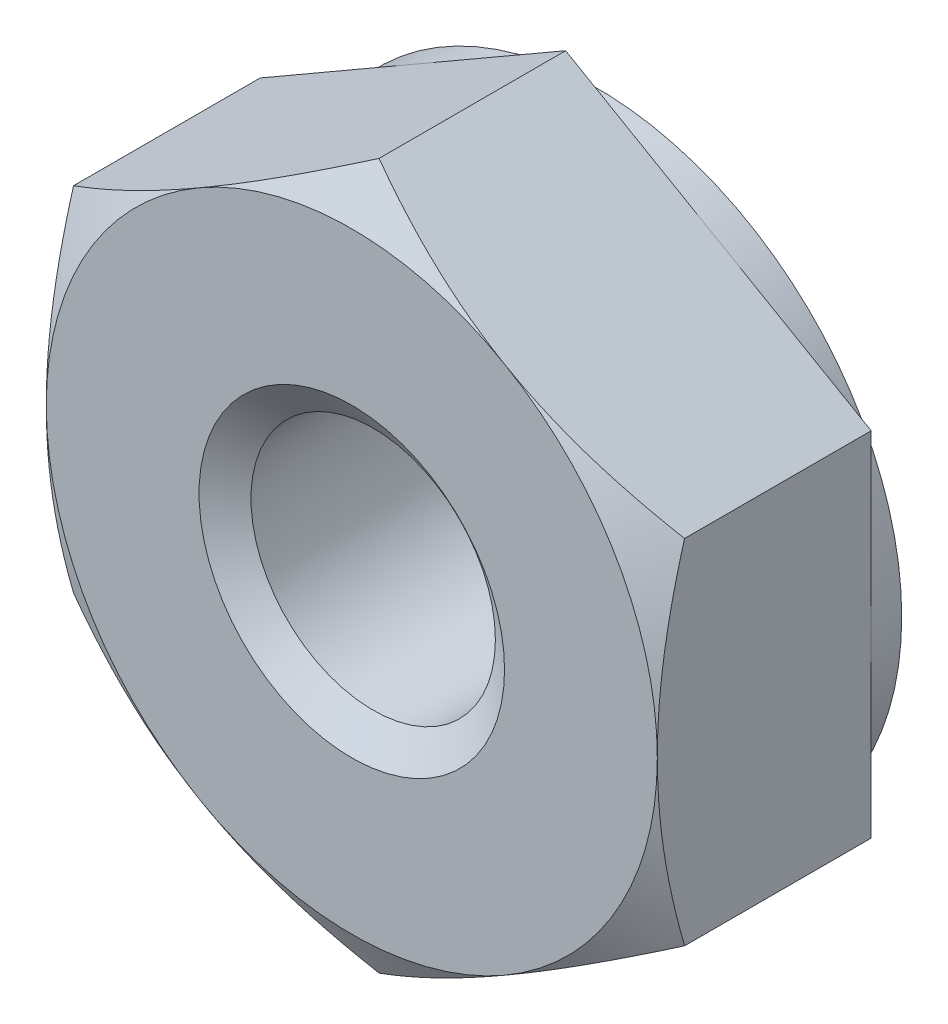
SolidWorks part; units mm, degrees
ref_plane "Plane1" through (0, 0, 0) normal (0, 0, 1) x (1, 0, 0)
ref_plane "Plane2" through (0, 0, 0) normal (0, 1, 0) x (1, 0, 0)
ref_plane "Plane3" through (0, 0, 0) normal (1, 0, 0) x (0, 0, -1)
revolve "EndChamfer" cut sketch "Sketch5"
sketch "Sketch5"
  line L0 (1.5746, 1) -> (1.4206, 0.78)
  line L1 (1.6254, 1) -> (1.5746, 1)
  line L2 (1.6254, 1) -> (1.6254, 0.78)
  line L3 (1.6254, 0.78) -> (1.4206, 0.78)
  line L6 (-0.0508, 1) -> (0, 1)
  line L7 (0, 1) -> (0.154, 0.78)
  line L9 (0.154, 0.78) -> (-0.0508, 0.78)
  line L10 (-0.0508, 0.78) -> (-0.0508, 1)
  line L11 (25.0375, 0) -> (38.388, 0) construction
  line L12 (1.6, 0) -> (0, 0) construction
extrude "BaseNut" add sketch "BaseNutSke" against normal blind 1.6
sketch "BaseNutSke" plane through (0, 0, 0) normal (0, 0, 1) x (1, 0, 0)
  line L6 (2, 1.1547) -> (2, -1.1547)
  line L7 (-2, 1.1547) -> (-2, -1.1547)
  line L8 (2, 1.1547) -> (0, 2.3094)
  line L9 (0, 2.3094) -> (-2, 1.1547)
  line L10 (-2, -1.1547) -> (0, -2.3094)
  line L11 (0, -2.3094) -> (2, -1.1547)
  circle A0 centre (0, 0) radius 0.8
  dimension "D4" = 2
  dimension "Tap_drill" = 1.6
  dimension "D1" = 120
  dimension "D2" = 2
  dimension "D3" = 2
  dimension "Width_flats" = 4
pattern_linear "ThdSchPat" [suppressed]
revolve "ThreadSchematic" cut sketch "ThdSchSke" angle 360 about L11
sketch "ThdSchSke" plane through (0, 0, 0) normal (0, 1, 0) x (1, 0, 0)
  line L0 (-1, 0.0254) -> (-0.8, 0.1654)
  line L1 (-0.8, 0.1654) -> (-0.4, 0.1654)
  line L2 (-0.4, 0.1654) -> (-0.4, -0.1146)
  line L3 (-0.4, -0.1146) -> (-0.8, -0.1146)
  line L4 (-0.8, -0.1146) -> (-1, 0.0254)
  line L5 (-3.175, 0.4) -> (3.175, 0.4) construction
  line L6 (0, 0.4) -> (0, -2.9874) construction
  line L7 (0, 1.4346) -> (0, 0.14) construction
  dimension "D1" = 35
  dimension "VeeAngle" = 70
  dimension "SideAngle" = 55
  dimension "D2" = 0.0508
  dimension "OverCut" = 0.8
  dimension "Tap_Drill" = 1.6
  dimension "Advance" = 0.3873
  dimension "Thread_major" = 2
  dimension "Num_threads" = 5
  dimension "D4" = 50
  dimension "Offset1" = 1.6254
  dimension "ThreadMajor" = 1
  dimension "ChamferDepth" = 0.22
  dimension "Offset2" = 1.6762
sketch "Sketch4" plane through (0, 0, 0) normal (1, 0, 0) x (0, 0, -1)
  line L0 (1.6, 2) -> (1.4, 2)
  line L1 (1.6, 2) -> (1.6, 12.3094)
  line L2 (1.4, 12.3094) -> (1.6, 12.3094)
  line L3 (1.4, 12.3094) -> (1.4, 2)
  line L4 (0, 0) -> (34.925, 0) construction
  line L6 (1.6, 1.1547) -> (1.6, 2.3094) construction
  line L7 (0, 2) -> (-10, 2)
  line L8 (0, 1.1547) -> (0, 2.3094) construction
  line L9 (0.1786, 2.3094) -> (0.1786, 12.3094)
  line L10 (0.1786, 12.3094) -> (-10, 12.3094)
  line L11 (-10, 12.3094) -> (-10, 2)
  line L12 (0, 2) -> (0.1786, 2.3094)
  line L14 (0, 1.1547) -> (0, -1.1547) construction
  line L15 (1.6, 2.3094) -> (0, 2.3094) construction
  dimension "D1" = 2
  dimension "D2" = 30
  dimension "Bearing_ht" = 0.2
  dimension "D3" = 10
  dimension "D4" = 10
revolve "Bearing-Face" cut sketch "Sketch4" angle 360 about L4
sketch "Sketch3" plane through (0, 0, 0) normal (1, 0, 0) x (0, 0, -1)
  line L0 (1.6, 2) -> (1.4214, 2.3094)
  line L1 (1.4214, 2.3094) -> (1.4214, 12.3094)
  line L2 (1.4214, 12.3094) -> (11.6, 12.3094)
  line L3 (11.6, 12.3094) -> (11.6, 2)
  line L4 (11.6, 2) -> (1.6, 2)
  line L5 (1.6, 1.1547) -> (1.6, 2.3094) construction
  line L6 (1.4, 2.3094) -> (0.1786, 2.3094) construction
  line L7 (0, 0) -> (38.6776, 0) construction
  line L8 (1.6, 0) -> (0, 0) construction
  line L9 (0.7893, 2.3094) -> (0.7893, 44.222) construction
  line L10 (0.1573, 12.3094) -> (-10.0214, 12.3094)
  line L11 (-10.0214, 12.3094) -> (-10.0214, 2)
  line L12 (-10.0214, 2) -> (-0.0214, 2)
  line L13 (-0.0214, 2) -> (0.1573, 2.3094)
  line L14 (0.1573, 2.3094) -> (0.1573, 12.3094)
  line L16 (1.4, 2.3094) -> (0.1786, 2.3094) construction
  dimension "D1" = 2
  dimension "D2" = 30
  dimension "D3" = 10
  dimension "D4" = 10
revolve "Double-Chamfer" [suppressed] cut sketch "Sketch3" angle 360 about L7
equation "\"D2@BaseNutSke\" = \"Width_flats@BaseNutSke\" / 2"
equation "\"D3@BaseNutSke\" = \"Width_flats@BaseNutSke\" / 2"
equation "\"D1@Sketch3\" = \"Width_flats@BaseNutSke\" /2"
equation "\"D1@Sketch4\" = \"D2@BaseNutSke\""
equation "\"D4@BaseNutSke\" = \"D3@BaseNutSke\""
equation "\"Thread_major@ThdSchSke\" = \"Thread_major@ThreadCosmetic\""
equation "\"Tap_drill@ThdSchSke\" = \"Tap_drill@BaseNutSke\""
equation "\"Overcut@ThdSchSke\" = \"Tap_drill@ThdSchSke\" * 0.5"
equation "\"Num_threads@ThdSchPat\" = int(  ( \"Thickness@BaseNut\" - 0.0508 ) / \"Advance@ThdSchSke\" + 0.999 )  + 1"
equation "\"Advance@ThdSchPat\" = ( \"Thickness@BaseNut\" - 0.0508 ) /  (\"Num_threads@ThdSchPat\" - 1) 'relax it"
equation "' \"Num_threads@ThdSchPat\" = \"Num_threads@ThdSchPat\" - sgn( \"Num_threads@ThdSchPat\" - 1) '---chamfered tips only---"
equation "\"ThreadMajor@Sketch5\" = \"Thread_major@ThreadCosmetic\" * 0.5"
equation "\"ChamferDepth@Sketch5\" = (\"Thread_major@ThreadCosmetic\" - \"Tap_drill@BaseNutSke\") * 0.55"
equation "\"Offset1@Sketch5\" = \"Thickness@BaseNut\" + 0.0254"
equation "\"Offset2@Sketch5\" = \"Offset1@Sketch5\" + 0.0508"
